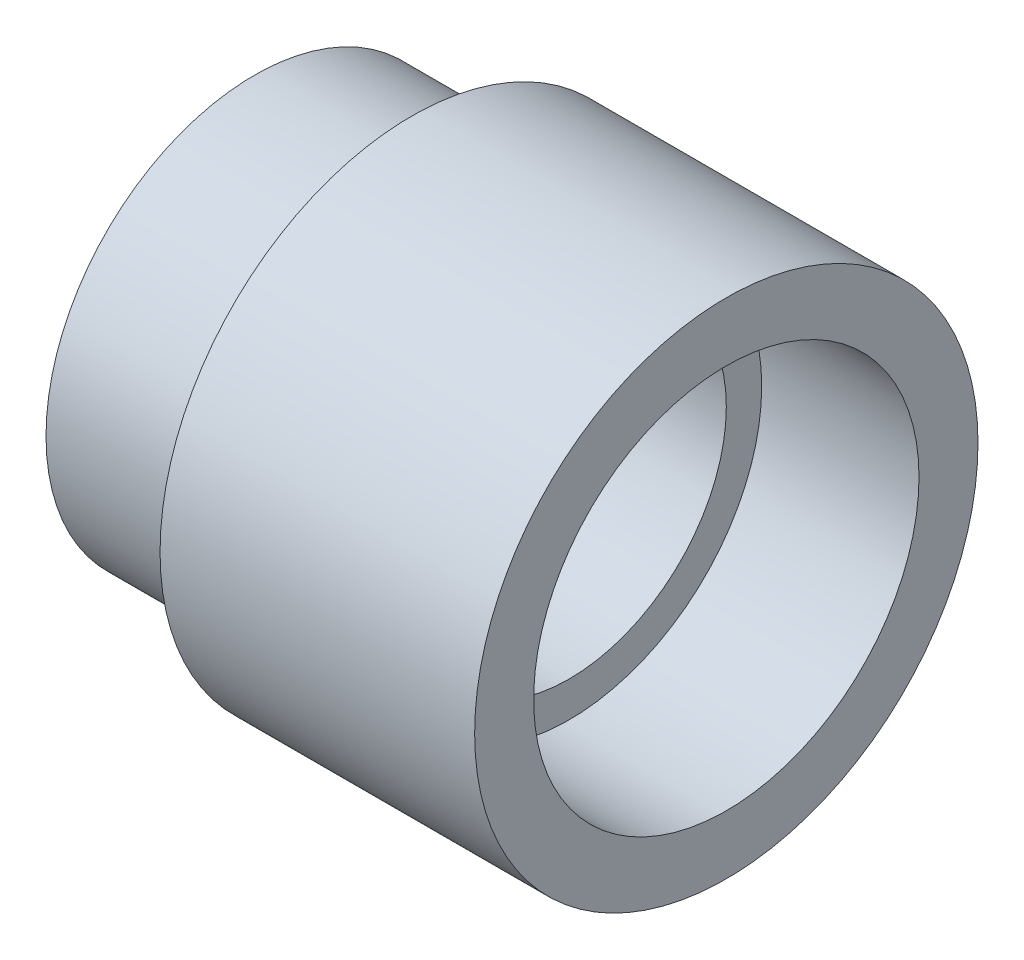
SolidWorks part; units mm, degrees
ref_plane "Plan de face" through (0, 0, 0) normal (0, 0, 1) x (1, 0, 0)
ref_plane "Plan de dessus" through (0, 0, 0) normal (0, 1, 0) x (1, 0, 0)
ref_plane "Plan de droite" through (0, 0, 0) normal (1, 0, 0) x (0, 0, -1)
sketch "Esquisse1" plane through (0, 0, 0) normal (0, 0, 1) x (1, 0, 0)
  line L0 (-73.5094, 0) -> (142.3906, 0) construction
  line L2 (0, 10) -> (30, 10)
  line L3 (0, 10) -> (0, 16)
  line L4 (0, 16) -> (30, 16)
  line L5 (30, 10) -> (30, 16)
  dimension "D1" = 20
  dimension "D2" = 32
  dimension "D3" = 30
revolve "Révolution1" add sketch "Esquisse1" angle 360 about L0
sketch "Esquisse2" plane through (0, 0, 0) normal (-1, 0, 0) x (0, 0, 1)
  circle A0 centre (0, 0) radius 13.25
  circle A1 centre (0, 0) radius 16
  dimension "D1" = 26.5
extrude "filetage-nez de robinet diametre 26.5-G3-4 " cut sketch "Esquisse2" against normal blind 10
sketch "Esquisse3" plane through (30, 0, 0) normal (1, 0, 0) x (0, 0, -1)
  circle A0 centre (0, 0) radius 12.25
  dimension "D1" = 24.5
extrude "Enlèv. mat.-Extru.1" cut sketch "Esquisse3" against normal blind 10
